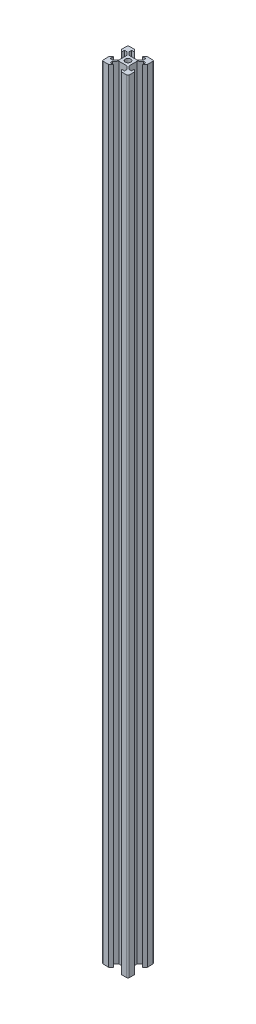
SolidWorks part; units mm, degrees
ref_plane "Front Plane" through (0, 0, 0) normal (0, 0, 1) x (1, 0, 0)
ref_plane "Top Plane" through (0, 0, 0) normal (0, 1, 0) x (1, 0, 0)
ref_plane "Right Plane" through (0, 0, 0) normal (1, 0, 0) x (0, 0, -1)
sketch "Sketch1" plane through (0, 0, 0) normal (0, 1, 0) x (1, 0, 0)
  line L0 (4.3042, -1.1645) -> (6.8197, -3.5914)
  line L1 (-9.5958, 11.9005) -> (10.4042, 11.9005)
  line L2 (-9.5958, 11.9005) -> (-9.5958, -8.0995)
  line L3 (-9.5958, -8.0995) -> (10.4042, -8.0995)
  line L4 (10.4042, 11.9005) -> (10.4042, -8.0995)
  line L5 (0.4042, -8.0995) -> (-2.6608, -8.0995)
  line L6 (0.4042, -8.0995) -> (3.4692, -8.0995)
  line L7 (-5.0876, -6.2995) -> (-5.0876, -4.5151)
  line L8 (0.4042, -8.0995) -> (-5.0876, -8.0995)
  line L9 (0.4042, -8.0995) -> (5.9042, -8.0995)
  line L11 (-5.0876, -6.2995) -> (-2.6608, -6.2995)
  line L13 (-2.6608, -1.9995) -> (3.4692, -1.9995)
  line L15 (-5.0958, 11.9005) -> (0.4042, 11.9005)
  line L16 (0.4042, 11.9005) -> (5.9042, 11.9005)
  line L17 (-2.6608, 11.9005) -> (3.4692, 11.9005)
  line L18 (-3.8758, 11.9005) -> (4.6842, 11.9005)
  line L19 (-5.0876, -8.0995) -> (-3.8758, -8.0995)
  line L21 (-2.6608, -1.9995) -> (-5.0876, -4.5151)
  line L23 (5.9042, -6.2995) -> (3.4692, -6.2995)
  line L24 (5.9042, -6.2995) -> (5.9042, -4.5151)
  line L25 (3.4692, -1.9995) -> (5.9042, -4.5151)
  line L26 (8.6042, -3.5914) -> (6.8197, -3.5914)
  line L27 (-7.7958, -3.5914) -> (-6.0113, -3.5914)
  line L28 (-7.7958, -3.5914) -> (-7.7958, -1.1645)
  line L31 (-7.7958, 7.4005) -> (-7.7958, 4.9655)
  line L32 (-7.7958, 7.4005) -> (-6.0113, 7.4005)
  line L33 (-3.4958, 4.9655) -> (-6.0113, 7.4005)
  line L34 (-3.4958, -1.1645) -> (-3.4958, 4.9655)
  line L35 (-3.4958, -1.1645) -> (-6.0113, -3.5914)
  line L36 (3.4692, 5.8005) -> (5.9042, 8.316)
  line L37 (5.9042, 10.1005) -> (5.9042, 8.316)
  line L38 (5.9042, 10.1005) -> (3.4692, 10.1005)
  line L41 (-5.0876, 10.1005) -> (-2.6608, 10.1005)
  line L42 (-5.0876, 10.1005) -> (-5.0876, 8.316)
  line L43 (-2.6608, 5.8005) -> (3.4692, 5.8005)
  line L44 (-2.6608, 5.8005) -> (-5.0876, 8.316)
  line L45 (8.6042, -3.5914) -> (8.6042, -1.1645)
  line L48 (8.6042, 7.4005) -> (8.6042, 4.9655)
  line L49 (8.6042, 7.4005) -> (6.8197, 7.4005)
  line L50 (4.3042, 4.9655) -> (6.8197, 7.4005)
  line L51 (4.3042, -1.1645) -> (4.3042, 4.9655)
  line L52 (-9.5958, 6.1805) -> (-9.5958, -2.3795)
  line L53 (-3.8758, -8.0995) -> (4.6842, -8.0995)
  line L54 (10.4042, -2.3795) -> (10.4042, 6.1805)
  line L55 (-3.8758, -8.0995) -> (-4.4458, -8.0995)
  line L56 (-4.4458, -8.0995) -> (-2.6608, -6.2995)
  line L57 (4.6842, -8.0995) -> (5.2542, -8.0995)
  line L58 (5.2542, -8.0995) -> (3.4692, -6.2995)
  line L59 (10.4042, -2.3795) -> (10.4042, -2.9495)
  line L60 (10.4042, -2.9495) -> (8.6042, -1.1645)
  line L61 (10.4042, 6.1805) -> (10.4042, 6.7505)
  line L62 (10.4042, 6.7505) -> (8.6042, 4.9655)
  line L63 (4.6842, 11.9005) -> (5.2542, 11.9005)
  line L64 (5.2542, 11.9005) -> (3.4692, 10.1005)
  line L65 (-3.8758, 11.9005) -> (-4.4458, 11.9005)
  line L66 (-4.4458, 11.9005) -> (-2.6608, 10.1005)
  line L67 (-9.5958, 6.1805) -> (-9.5958, 6.7505)
  line L68 (-9.5958, 6.7505) -> (-7.7958, 4.9655)
  line L69 (-9.5958, -2.3795) -> (-9.5958, -2.9495)
  line L70 (-9.5958, -2.9495) -> (-7.7958, -1.1645)
  circle A0 centre (0.4042, 1.9005) radius 2.1
  dimension "D1" = 1.7845
extrude "Boss-Extrude1" add sketch "Sketch1" along normal blind 600
fillet "Fillet1" radius 1 4 edges at (10.4042, 300, 8.0995) (-9.5958, 300, 8.0995) (10.4042, 300, -11.9005) (-9.5958, 300, -11.9005)
